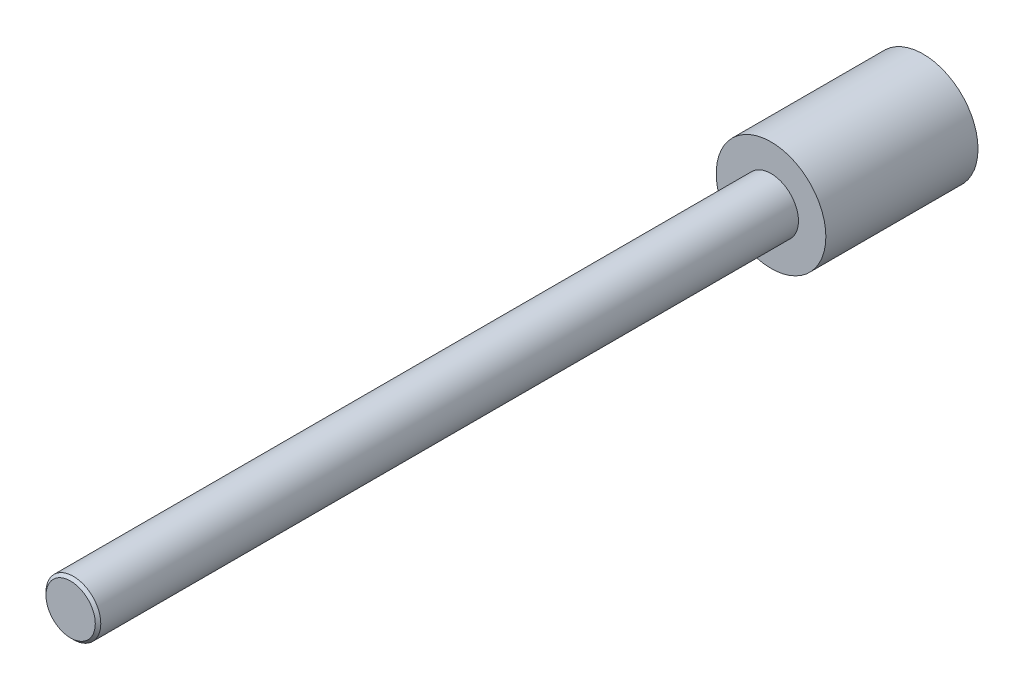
SolidWorks part; units mm, degrees
ref_plane "Front" through (0, 0, 0) normal (0, 0, 1) x (1, 0, 0)
ref_plane "Top" through (0, 0, 0) normal (0, 1, 0) x (1, 0, 0)
ref_plane "Right" through (0, 0, 0) normal (1, 0, 0) x (0, 0, -1)
ref_plane "Shaft Plane 1" through (0, 0, -0.254) normal (0, 0, 1) x (1, 0, 0)
sketch "Sketch1" plane through (0, 0, 0) normal (0, 0, 1) x (1, 0, 0)
  circle A0 centre (0, 0) radius 2.54
  dimension "活塞杆径" = 5.08
extrude "Base-Extrude" add sketch "Sketch1" along normal blind 78.74
sketch "Sketch2" plane through (0, 0, -0.254) normal (0, 0, 1) x (1, 0, 0)
  circle A0 centre (0, 0) radius 5.08
  dimension "活塞径" = 10.16
extrude "Boss-Extrude1" add sketch "Sketch2" along normal blind 14.097
chamfer "Chamfer1" distance 0.254 angle 45 1 edges at (2.54, 0, 78.74)
